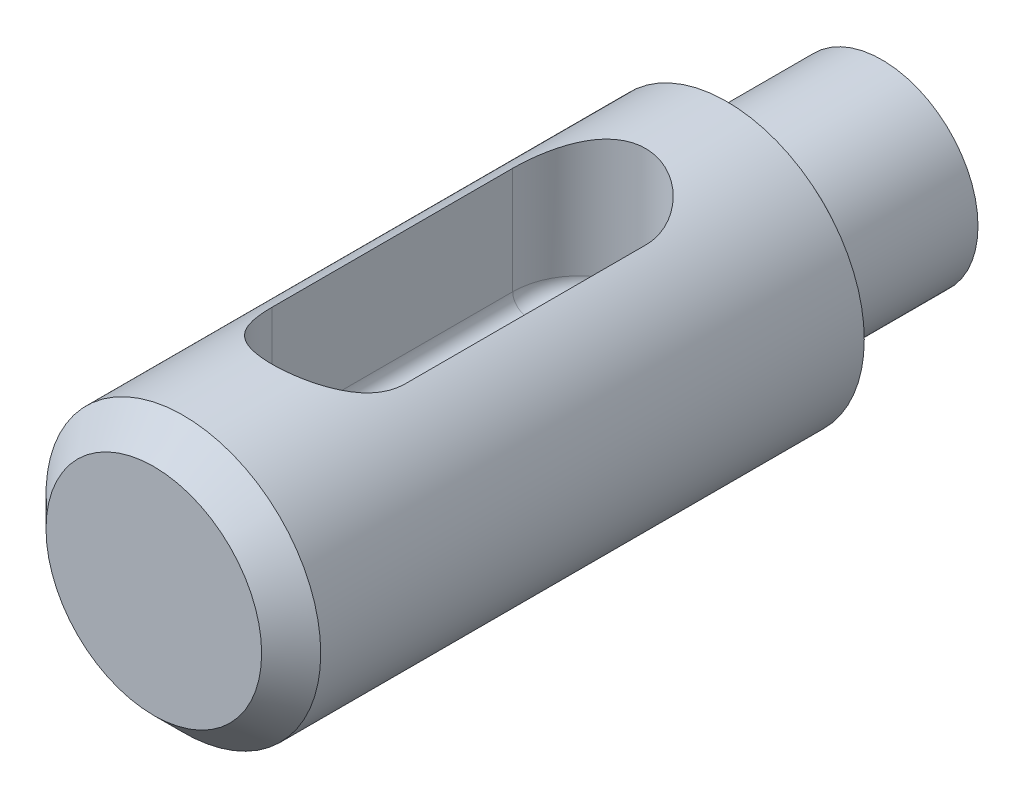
SolidWorks part; units mm, degrees
ref_plane "Front Plane" through (0, 0, 0) normal (0, 0, 1) x (1, 0, 0)
ref_plane "Top Plane" through (0, 0, 0) normal (0, 1, 0) x (1, 0, 0)
ref_plane "Right Plane" through (0, 0, 0) normal (1, 0, 0) x (0, 0, -1)
sketch "Sketch1" plane through (0, 0, 0) normal (0, 1, 0) x (1, 0, 0)
  line L0 (0, 0) -> (0, 12.5222)
  line L1 (0, 0) -> (-1.8542, 0)
  line L2 (-2.3622, 0.508) -> (-2.3622, 9.8552)
  line L3 (-2.3622, 9.8552) -> (-2.159, 9.8552)
  line L4 (-1.651, 10.3632) -> (-1.651, 12.5222)
  line L5 (-1.651, 12.5222) -> (0, 12.5222)
  line L6 (0, 0) -> (0, 14.3147) construction
  line L7 (-1.8542, 0) -> (-2.3622, 0.508)
  arc A0 (-2.159, 9.8552) -> (-1.651, 10.3632) centre (-2.159, 10.3632) ccw
  point P4 (-2.3622, 0)
  point P10 (-1.651, 9.8552)
  dimension "D5" = 0.508
  dimension "D1" = 12.5222
  dimension "D2" = 3.302
  dimension "D3" = 4.7244
  dimension "D4" = 2.667
  dimension "D6" = 0.508
  dimension "D7" = 45
revolve "Revolve1" add sketch "Sketch1" angle 360 about L6
sketch "Sketch2" plane through (0, 0, 0) normal (0, 1, 0) x (1, 0, 0)
  line L0 (0, 0) -> (0, 12.5222) construction
  line L1 (1.651, 12.5222) -> (-1.651, 12.5222) construction
  line L2 (0, 3.175) -> (0, 7.3152) construction
  line L3 (-1.143, 3.175) -> (-1.143, 7.3152)
  line L4 (1.143, 3.175) -> (1.143, 7.3152)
  arc A0 (-1.143, 3.175) -> (1.143, 3.175) centre (0, 3.175) ccw
  arc A1 (1.143, 7.3152) -> (-1.143, 7.3152) centre (0, 7.3152) ccw
  point P7 (0, 5.2451)
  point P12 (0, 8.4582)
  point P13 (0, 2.032)
  dimension "D1" = 2.286
  dimension "D2" = 6.4262
  dimension "D3" = 10.4902
extrude "Cut-Extrude1" cut sketch "Sketch2" along normal up to surface and the other way blind 0.0254
fillet "Fillet1" radius 0.254 4 edges at (-1.143, -0.0254, -5.2451) (0, -0.0254, -8.4582) (1.143, -0.0254, -5.2451) (0, -0.0254, -2.032)
